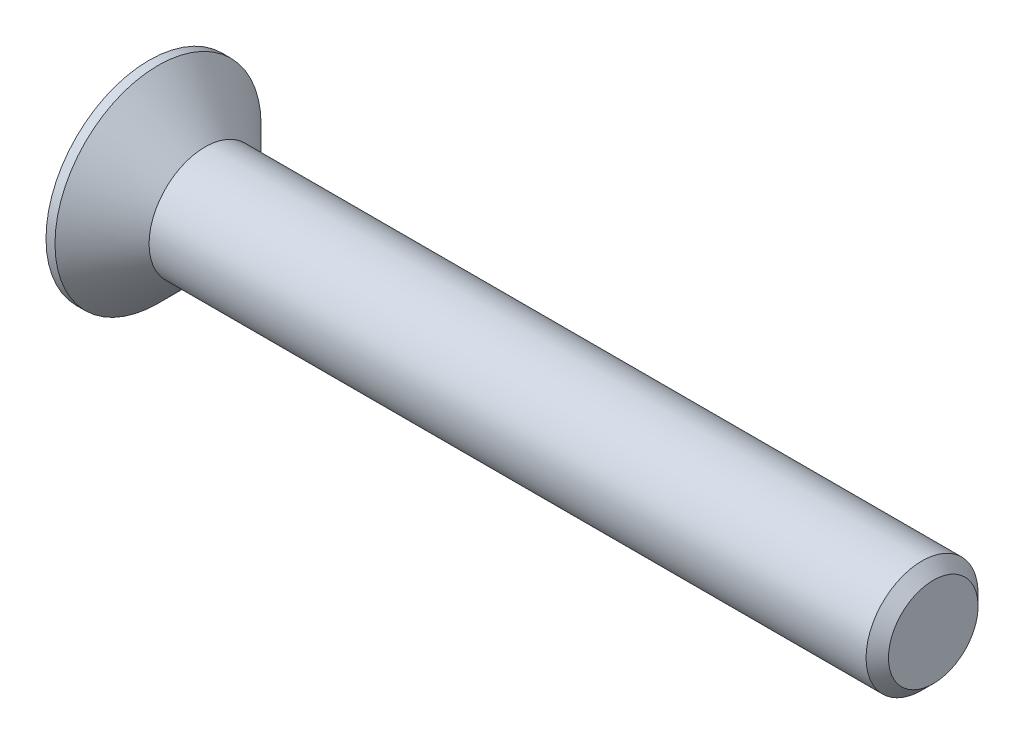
SolidWorks part; units mm, degrees
ref_plane "Front Plane" through (0, 0, 0) normal (0, 0, 1) x (1, 0, 0)
ref_plane "Top Plane" through (0, 0, 0) normal (0, 1, 0) x (1, 0, 0)
ref_plane "Right Plane" through (0, 0, 0) normal (1, 0, 0) x (0, 0, -1)
sketch "Sketch1" plane through (0, 0, 0) normal (0, 0, 1) x (1, 0, 0)
  line L1 (-2.5, 4.6) -> (-2.5, 0)
  line L2 (-2.5, 0) -> (32.5, 0)
  line L3 (32.5, 0) -> (32.5, 2.5)
  line L4 (32.5, 2.5) -> (0, 2.5)
  line L5 (-2.5, 4.6) -> (-2.1, 4.6)
  line L6 (-2.1, 4.6) -> (0, 2.5)
  dimension "D1" = 2.5
  dimension "D2" = 45
  dimension "D3" = 2.5
  dimension "D4" = 35
  dimension "D5" = 4.6
revolve "Revolve1" add sketch "Sketch1" angle 360 about L2
chamfer "Chamfer1" distance 0.5 angle 45 1 edges at (32.5, 0, 2.5)
sketch "Sketch2" plane through (-2.5, 0, 0) normal (-1, 0, 0) x (0, 0, 1)
  line L0 (-0.575, 2.3) -> (0.575, 2.3)
  line L1 (0.575, 2.3) -> (0.575, 0.575)
  line L2 (0.575, 0.575) -> (2.3, 0.575)
  line L3 (2.3, 0.575) -> (2.3, -0.575)
  line L4 (2.3, -0.575) -> (0.575, -0.575)
  line L5 (0.575, -0.575) -> (0.575, -2.3)
  line L6 (0.575, -2.3) -> (-0.575, -2.3)
  line L7 (-0.575, -2.3) -> (-0.575, -0.575)
  line L8 (-0.575, -0.575) -> (-2.3, -0.575)
  line L9 (-2.3, -0.575) -> (-2.3, 0.575)
  line L10 (-2.3, 0.575) -> (-0.575, 0.575)
  line L11 (-0.575, 0.575) -> (-0.575, 2.3)
  point P2 (0, 2.3)
  point P14 (0, -2.3)
  point P15 (2.3, 0)
  point P16 (-2.3, 0)
  dimension "D1" = 4.6
  dimension "D2" = 1.15
extrude "Cut-Extrude1" cut sketch "Sketch2" against normal blind 2.1
